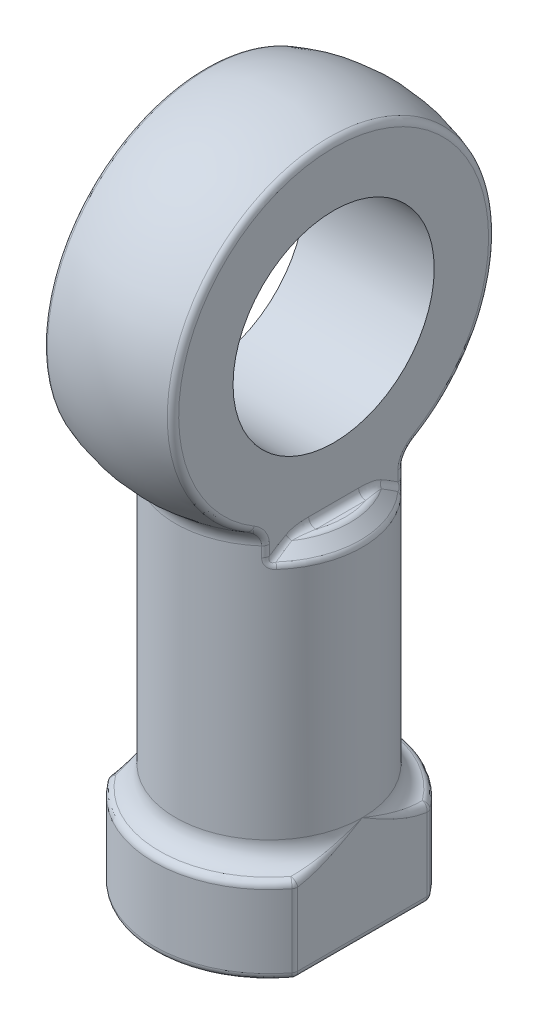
SolidWorks part; units mm, degrees
ref_plane "Plan de face" through (0, 0, 0) normal (0, 0, 1) x (1, 0, 0)
ref_plane "Plan de dessus" through (0, 0, 0) normal (0, 1, 0) x (1, 0, 0)
ref_plane "Plan de droite" through (0, 0, 0) normal (1, 0, 0) x (0, 0, -1)
sketch "Esquisse1" plane through (0, 0, 0) normal (0, 0, 1) x (1, 0, 0)
  line L0 (0, 12) -> (0, -36.0871)
  line L1 (6.5, -10.0871) -> (6.5, -30.0871)
  line L2 (0, 15.5754) -> (0, -46.3703) construction
  line L4 (6.5, -30.0871) -> (8, -30.0871)
  line L5 (0, -36.0871) -> (8, -36.0871)
  line L6 (8, -30.0871) -> (8, -36.0871)
  arc A0 (6.5, -10.0871) -> (0, 12) centre (0, 0) ccw
  dimension "D1" = 24
  dimension "D2" = 8
  dimension "D3" = 20
  dimension "D4" = 1.5
  dimension "D9" = 26
revolve "Révolution1" add sketch "Esquisse1" angle 360 about L2
ref_plane "Plan1" through (0, 13.9129, 0) normal (0, -1, 0) x (1, 0, 0)
sketch "Esquisse2" plane through (0, 13.9129, 0) normal (0, -1, 0) x (1, 0, 0)
  line L1 (-4.5, 15.7483) -> (-14.8514, 15.7483)
  line L2 (-4.5, 15.7483) -> (-4.5, -16.81)
  line L3 (-4.5, -16.81) -> (-14.8514, -16.81)
  line L4 (-14.8514, 15.7483) -> (-14.8514, -16.81)
  line L5 (15.8091, 15.7483) -> (4.5, 15.7483)
  line L6 (15.8091, 15.7483) -> (15.8091, -16.81)
  line L7 (15.8091, -16.81) -> (4.5, -16.81)
  line L8 (4.5, 15.7483) -> (4.5, -16.81)
  dimension "D1" = 9
  dimension "D2" = 4.5
extrude "Enlèv. mat.-Extru.1" cut sketch "Esquisse2" along normal blind 25
chamfer "Chanfrein1" distance 1 angle 45 2 edges at (6.5, -11.0871, 0) (-6.5, -11.0871, 0)
sketch "Esquisse3" plane through (-4.5, 0, 0) normal (-1, 0, 0) x (0, 0, 1)
  circle A0 centre (0, 0) radius 7
  dimension "D1" = 14
extrude "Enlèv. mat.-Extru.2" cut sketch "Esquisse3" against normal through all
fillet "Congé1" radius 1.5 1 edges at (0, -30.0871, 6.5)
sketch "Esquisse4" plane through (0, -36.0871, 0) normal (0, -1, 0) x (1, 0, 0)
  line L1 (6.5, 9.4578) -> (9.7356, 9.4578)
  line L2 (6.5, 9.4578) -> (6.5, -9.1378)
  line L3 (6.5, -9.1378) -> (9.7356, -9.1378)
  line L4 (9.7356, 9.4578) -> (9.7356, -9.1378)
  line L5 (-10.34, 9.8133) -> (-6.5, 9.8133)
  line L6 (-10.34, 9.8133) -> (-10.34, -9.1378)
  line L7 (-10.34, -9.1378) -> (-6.5, -9.1378)
  line L8 (-6.5, 9.8133) -> (-6.5, -9.1378)
  dimension "D1" = 13
  dimension "D2" = 6.5
extrude "Enlèv. mat.-Extru.3" cut sketch "Esquisse4" against normal blind 8
fillet "Congé2" radius 0.5 8 edges at (6.5, -33.0871, -4.6637) (6.5, -33.0871, 4.6637) (6.5, -29.7639, -2.7808) (6.5, -28.1453, 6.8367) (-6.5, -33.0871, 4.6637) (-6.5, -33.0871, -4.6637) (-6.5, -28.2273, 6.868) (-6.5, -29.7361, -2.6928)
fillet "Congé3" radius 0.5 14 edges at (6.4851, -30.4187, -4.6213) (-6.4851, -30.4187, -4.6213) (-6.4743, -36.0871, 4.6581) (-6.5, -36.0871, 0) (-6.4743, -36.0871, -4.6581) (6.4743, -36.0871, -4.6581) (6.5, -36.0871, 0) (6.4743, -36.0871, 4.6581) (-6.4851, -30.4187, 4.6213) (6.4851, -30.4187, 4.6213) (0, -30.0871, -8) (0, -36.0871, -8) (0, -36.0871, 8) (0, -30.0871, 8)
fillet "Congé4" radius 0.5 2 edges at (4.5, 11.1243, 0) (-4.5, 11.1243, 0)
fillet "Congé5" radius 1.5 6 edges at (4.4451, -9.936, 4.7425) (4.3961, -9.9999, -4.7879) (-4.3961, -9.9999, 4.7879) (-4.4451, -9.936, -4.7425) (0, -10.0871, 6.5) (0, -10.0871, -6.5)
fillet "Congé7" radius 0.5 18 edges at (-4.5, -9.634, -5.0442) (-4.5, -9.6829, 5.003) (4.5, -9.634, 5.0442) (4.5, -9.6829, -5.003) (-4.5, -11.3378, -4.6904) (-4.5, -11.3378, 4.6904) (4.5, -11.3378, 4.6904) (4.5, -11.3378, -4.6904) (-4.5, -11.0871, 0) (4.5, -11.0871, 0) (6.5, -12.0871, 0) (5.5, -11.0871, 0) (-5.5, -11.0871, 0) (-6.5, -12.0871, 0)
hole_wizard "Dégagement M71" positions "Esquisse6" profile "Esquisse5" hole size "M7" standard "ISO"
sketch "Esquisse6" plane through (0, -36.0871, 0) normal (0, -1, 0) x (1, 0, 0)
  line L0 (6.5, 4.5) -> (6.5, -4.5) construction
  line L1 (6, 4.5) -> (6.5, 4.5) construction
  point P0 (0, 0)
  dimension "D1" = 6.5
  dimension "D2" = 4.5
sketch "Esquisse5" plane through (0, -36.0871, 0) normal (1, 0, 0) x (0, 0, -1)
  line L0 (0, 0) -> (0, 27.2833)
  line L1 (0, 27.2833) -> (3.8, 25)
  line L2 (3.8, 25) -> (3.8, 0)
  line L5 (3.8, 0) -> (0, 0)
  line L10 (0, 27.2833) -> (-3.8, 25) construction
  line L11 (0, -6.35) -> (0, 107.95) construction
  dimension "Diamètre du perçage" = 7.6
  dimension "Profondeur du perçage" = 25
  dimension "Angle de pointe" = 118
equation "\"D2@Esquisse1\" = 8"
